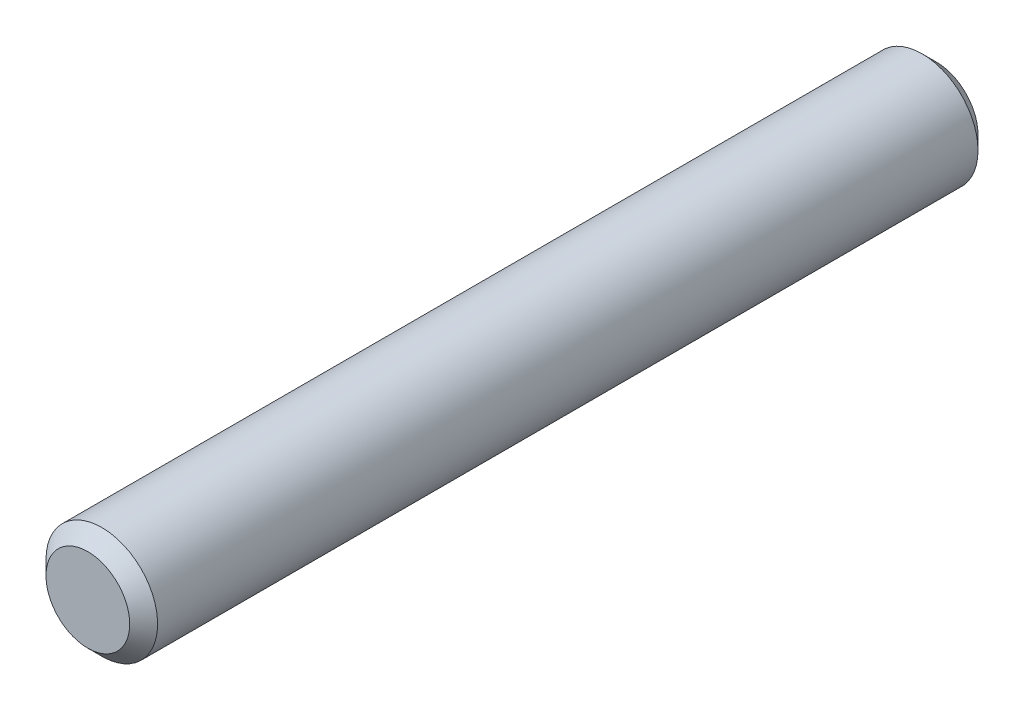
SolidWorks part; units mm, degrees
ref_plane "Plan1" through (0, 0, 0) normal (0, 0, 1) x (1, 0, 0)
ref_plane "Plan2" through (0, 0, 0) normal (0, 1, 0) x (1, 0, 0)
ref_plane "Plan3" through (0, 0, 0) normal (1, 0, 0) x (0, 0, -1)
sketch "Esquisse1" plane through (0, 0, 0) normal (0, 0, 1) x (1, 0, 0)
  circle A1 centre (-11.3689, 14.538) radius 2 construction
  circle A3 centre (-11.3689, 14.538) radius 2
extrude "Base-Extrusion" add sketch "Esquisse1" along normal blind 30.4
chamfer "Chanfrein2" distance 0.5 angle 45
